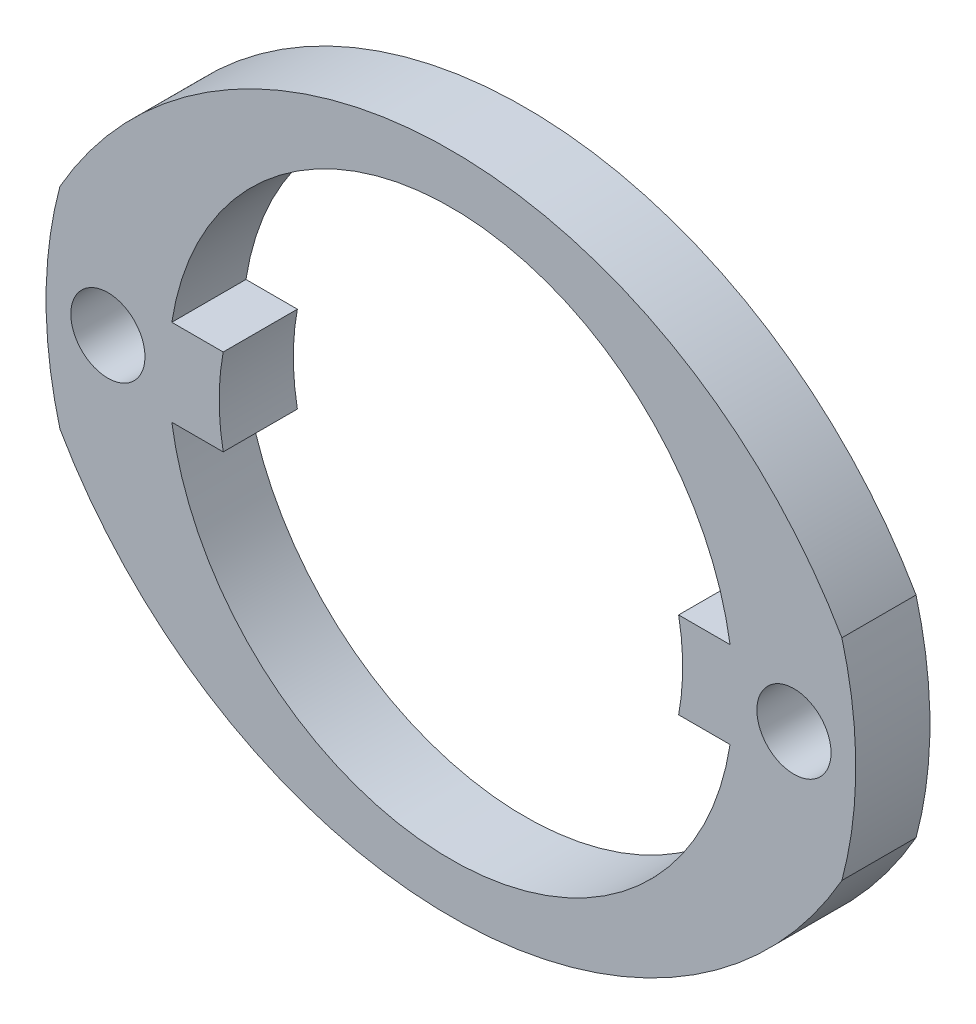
SolidWorks part; units mm, degrees
ref_plane "Front Plane" through (0, 0, 0) normal (0, 0, 1) x (1, 0, 0)
ref_plane "Top Plane" through (0, 0, 0) normal (0, 1, 0) x (1, 0, 0)
ref_plane "Right Plane" through (0, 0, 0) normal (1, 0, 0) x (0, 0, -1)
sketch "Sketch1" plane through (0, 0, 0) normal (0, 0, 1) x (1, 0, 0)
  line L0 (-28.0105, -1.5241) -> (-25.9305, -1.5241)
  line L1 (-7.5101, -1.5241) -> (-5.4302, -1.5241)
  line L2 (-28.0105, 1.9759) -> (-25.9305, 1.9759)
  line L3 (-7.5101, 1.9759) -> (-5.4302, 1.9759)
  arc A0 (-28.0105, -1.5241) -> (-5.4302, -1.5241) centre (-16.7203, 0.2259) ccw
  arc A1 (-25.9305, 1.9759) -> (-25.9305, -1.5241) centre (-16.7203, 0.2259) ccw
  arc A2 (-7.5101, -1.5241) -> (-7.5101, 1.9759) centre (-16.7203, 0.2259) ccw
  arc A8 (-5.4302, 1.9759) -> (-28.0105, 1.9759) centre (-16.7203, 0.2259) ccw
  circle A9 centre (-2.8453, 0.2259) radius 1.5
  circle A10 centre (-30.5953, 0.2259) radius 1.5
  arc A27 (-32.5342, 4.4761) -> (-32.5342, -4.0242) centre (-16.7203, 0.2259) ccw
  arc A28 (-0.9065, -4.0242) -> (-0.9065, 4.4761) centre (-16.7203, 0.2259) ccw
  arc A29 (-0.9065, 4.4761) -> (-32.5342, 4.4761) centre (-16.7203, -4.5649) ccw
  arc A30 (-32.5342, -4.0242) -> (-0.9065, -4.0242) centre (-16.7203, 5.0167) ccw
extrude "Boss-Extrude1" add sketch "Sketch1" along normal blind 3
